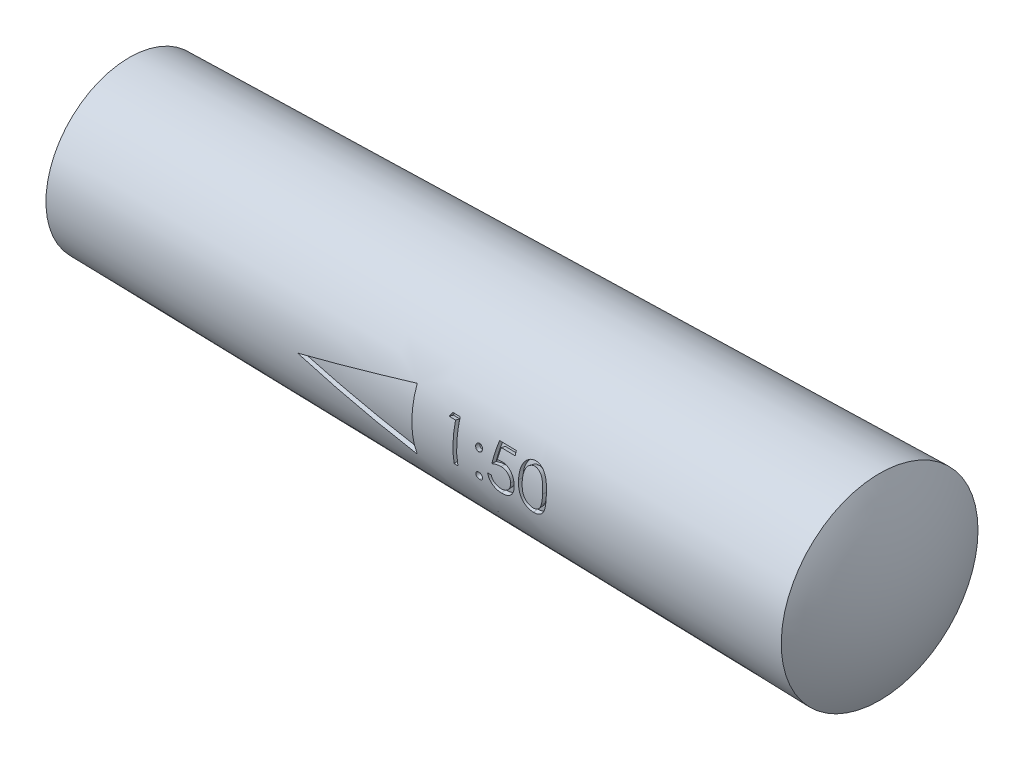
SolidWorks part; units mm, degrees
ref_plane "Front Plane" through (0, 0, 0) normal (0, 0, 1) x (1, 0, 0)
ref_plane "Top Plane" through (0, 0, 0) normal (0, 1, 0) x (1, 0, 0)
ref_plane "Right Plane" through (0, 0, 0) normal (1, 0, 0) x (0, 0, -1)
sketch "Sketch1" plane through (0, 0, 0) normal (1, 0, 0) x (0, 0, -1)
  circle A0 centre (0, 0) radius 2
  dimension "D1" = 4
extrude "Extrude1" add sketch "Sketch1" along normal mid plane 18
draft "Draft1" type of draft neutral plane draft angle 1.146 faces to draft 1 parameters "D1"=1.146
sketch "Sketch2" plane through (0, 0, 0) normal (0, 0, 1) x (1, 0, 0)
  line L0 (-9, 0) -> (-9, 2)
  line L1 (-9, 2) -> (-9, -2) construction
  line L2 (-9, 0) -> (-9.6, 0)
  line L3 (-9.6, 0) -> (-9.6, -2.18) construction
  line L4 (9, 0) -> (9, 2.36)
  line L5 (9, -2.36) -> (9, 2.36) construction
  line L6 (9, 0) -> (9.6, 0)
  line L7 (9.6, 0) -> (9.6, -2.18) construction
  line L8 (-9, -2) -> (9, -2.36) construction
  arc A0 (-9.6, 0) -> (-9, 2) centre (-5.9667, 0) cw
  arc A1 (9.6, 0) -> (9, 2.36) centre (4.6586, 0) ccw
  point P14 (0, -2.18)
revolve "Revolve1" add sketch "Sketch2" angle 360 about L2
sketch "Sketch5" plane through (0, 0, 0) normal (0, 0, 1) x (1, 0, 0)
  line L0 (0, 2.18) -> (0, -2.18) construction
  line L1 (9, 2.36) -> (-9, 2) construction
  line L2 (-9, -2) -> (9, -2.36) construction
ref_plane "Plane2" through (0, 0, 0) normal (-0.02, 0, 0.9998) x (0.9998, 0, 0.02)
sketch "Sketch6" plane through (0, 0, 0) normal (-0.02, 0, 0.9998) x (0.9998, 0, 0.02)
  line L0 (0, 0) -> (0, 0.75)
  line L1 (0, 2.18) -> (0, -2.18) construction
  line L2 (0, 0.75) -> (-2.799, 0)
  line L3 (-2.799, 0) -> (0, -0.75)
  line L4 (0, -0.75) -> (0, 0)
  line L5 (0, -0.375) -> (4, -0.375) construction
  text T0 "1:50" font "Century Gothic" height 1
  dimension "D1" = 1.5
  dimension "D2" = 30
  dimension "D3" = 4
wrap "Wrap2" sketch "Sketch6" wrap type deboss source sketch "Sketch6" thickness 0.1 parameters "D1"=0.1
equation "\"D2@Sketch2\" = \"D1@Sketch2\""
